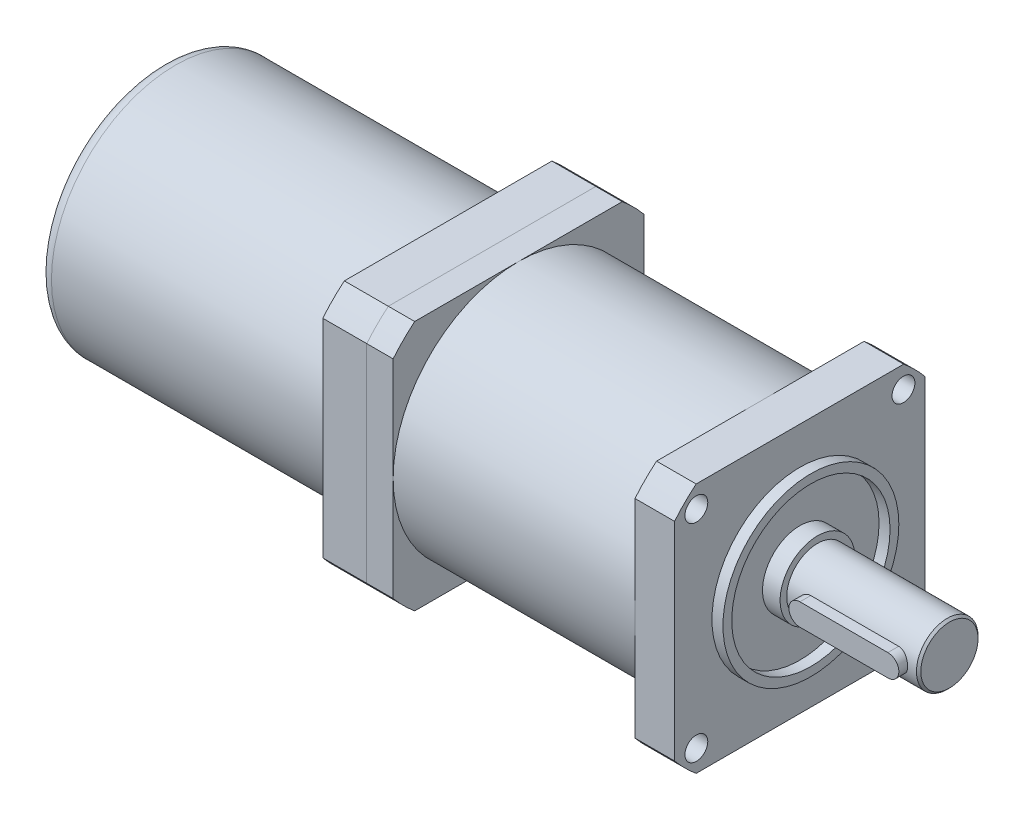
SolidWorks part; units mm, degrees
ref_plane "前视基准面" through (0, 0, 0) normal (0, 0, 1) x (1, 0, 0)
ref_plane "上视基准面" through (0, 0, 0) normal (0, 1, 0) x (1, 0, 0)
ref_plane "右视基准面" through (0, 0, 0) normal (1, 0, 0) x (0, 0, -1)
sketch "草图1" plane through (0, 0, 0) normal (1, 0, 0) x (0, 0, -1)
  line L1 (-23.5956, -28.5) -> (23.5956, -28.5)
  line L2 (-28.5, -23.5956) -> (-28.5, 23.5956)
  line L3 (-23.5956, 28.5) -> (23.5956, 28.5)
  line L4 (28.5, -23.5956) -> (28.5, 23.5956)
  line L5 (-26.163, -26.163) -> (26.163, 26.163) construction
  line L6 (-26.163, 26.163) -> (26.163, -26.163) construction
  arc A0 (-28.5, -23.5956) -> (-23.5956, -28.5) centre (0, 0) ccw
  arc A1 (-23.5956, 28.5) -> (-28.5, 23.5956) centre (0, 0) ccw
  arc A2 (28.5, 23.5956) -> (23.5956, 28.5) centre (0, 0) ccw
  arc A3 (23.5956, -28.5) -> (28.5, -23.5956) centre (0, 0) ccw
  point P0 (0, 0)
extrude "凸台-拉伸1" add sketch "草图1" against normal blind 9
sketch "草图2" plane through (-9, 0, 0) normal (-1, 0, 0) x (0, 0, 1)
  circle A0 centre (0, 0) radius 28.5
extrude "凸台-拉伸2" add sketch "草图2" along normal blind 55
sketch "草图3" plane through (-64, 0, 0) normal (-1, 0, 0) x (0, 0, 1)
  line L1 (-23.5956, -28.5) -> (23.5956, -28.5)
  line L2 (-28.5, -23.5956) -> (-28.5, 23.5956)
  line L3 (-23.5956, 28.5) -> (23.5956, 28.5)
  line L4 (28.5, -23.5956) -> (28.5, 23.5956)
  line L5 (-26.163, -26.163) -> (26.163, 26.163) construction
  line L6 (-26.163, 26.163) -> (26.163, -26.163) construction
  arc A0 (-28.5, -23.5956) -> (-23.5956, -28.5) centre (0, 0) ccw
  arc A1 (23.5956, -28.5) -> (28.5, -23.5956) centre (0, 0) ccw
  arc A2 (28.5, 23.5956) -> (23.5956, 28.5) centre (0, 0) ccw
  arc A3 (-23.5956, 28.5) -> (-28.5, 23.5956) centre (0, 0) ccw
  point P0 (0, 0)
extrude "凸台-拉伸3" add sketch "草图3" along normal blind 6
sketch "草图6" plane through (0, 0, 0) normal (1, 0, 0) x (0, 0, -1)
  circle A0 centre (-23.55, 23.55) radius 2.6
  circle A1 centre (23.55, 23.55) radius 2.6
  circle A2 centre (23.55, -23.55) radius 2.6
  circle A3 centre (-23.55, -23.55) radius 2.6
  point P0 (0, 0)
extrude "切除-拉伸2" cut sketch "草图6" against normal blind 9
sketch "草图7" plane through (0, 0, 0) normal (1, 0, 0) x (0, 0, -1)
  circle A0 centre (0, 0) radius 20
  circle A1 centre (0, 0) radius 18
extrude "凸台-拉伸5" add sketch "草图7" along normal blind 2.5
sketch "草图8" plane through (0, 0, 0) normal (1, 0, 0) x (0, 0, -1)
  circle A0 centre (0, 0) radius 8.5
extrude "凸台-拉伸6" add sketch "草图8" along normal blind 4
sketch "草图9" plane through (4, 0, 0) normal (1, 0, 0) x (0, 0, -1)
  circle A0 centre (0, 0) radius 7
extrude "凸台-拉伸7" add sketch "草图9" along normal blind 30
ref_plane "基准面1" through (0, 0, 7) normal (0, 0, 1) x (1, 0, 0)
sketch "草图10" plane through (0, 0, 7) normal (0, 0, 1) x (1, 0, 0)
  line L3 (9, 2.5) -> (29, 2.5)
  line L5 (29, -2.5) -> (9, -2.5)
  arc A0 (29, -2.5) -> (29, 2.5) centre (29, 0) ccw
  arc A1 (9, 2.5) -> (9, -2.5) centre (9, 0) ccw
extrude "切除-拉伸3" cut sketch "草图10" against normal blind 3
sketch "草图11" plane through (0, 0, 4) normal (0, 0, 1) x (1, 0, 0)
  line L0 (9, 2.5) -> (29, 2.5)
  line L2 (29, -2.5) -> (9, -2.5)
  arc A0 (9, 2.5) -> (9, -2.5) centre (9, 0) ccw
  arc A1 (29, -2.5) -> (29, 2.5) centre (29, 0) ccw
extrude "凸台-拉伸8" add sketch "草图11" along normal blind 5
chamfer "倒角1" distance 0.5 angle 45 1 edges at (34, 0, -7)
sketch "草图14" plane through (-70, 0, 0) normal (-1, 0, 0) x (0, 0, 1)
  line L1 (-23.5956, -28.5) -> (23.5956, -28.5)
  line L2 (-28.5, -23.5956) -> (-28.5, 23.5956)
  line L3 (-23.5956, 28.5) -> (23.5956, 28.5)
  line L4 (28.5, -23.5956) -> (28.5, 23.5956)
  line L5 (-26.163, -26.163) -> (26.163, 26.163) construction
  line L6 (-26.163, 26.163) -> (26.163, -26.163) construction
  arc A0 (-23.5956, 28.5) -> (-28.5, 23.5956) centre (0, 0) ccw
  arc A1 (-28.5, -23.5956) -> (-23.5956, -28.5) centre (0, 0) ccw
  arc A2 (23.5956, -28.5) -> (28.5, -23.5956) centre (0, 0) ccw
  arc A3 (28.5, 23.5956) -> (23.5956, 28.5) centre (0, 0) ccw
  point P0 (0, 0)
extrude "凸台-拉伸9" add sketch "草图14" along normal blind 10 separate body
sketch "草图15" plane through (-80, 0, 0) normal (-1, 0, 0) x (0, 0, 1)
  circle A0 centre (0, 0) radius 28.2
extrude "凸台-拉伸10" add sketch "草图15" along normal blind 65
fillet "圆角1" radius 3 1 edges at (-145, 0, 28.2)
